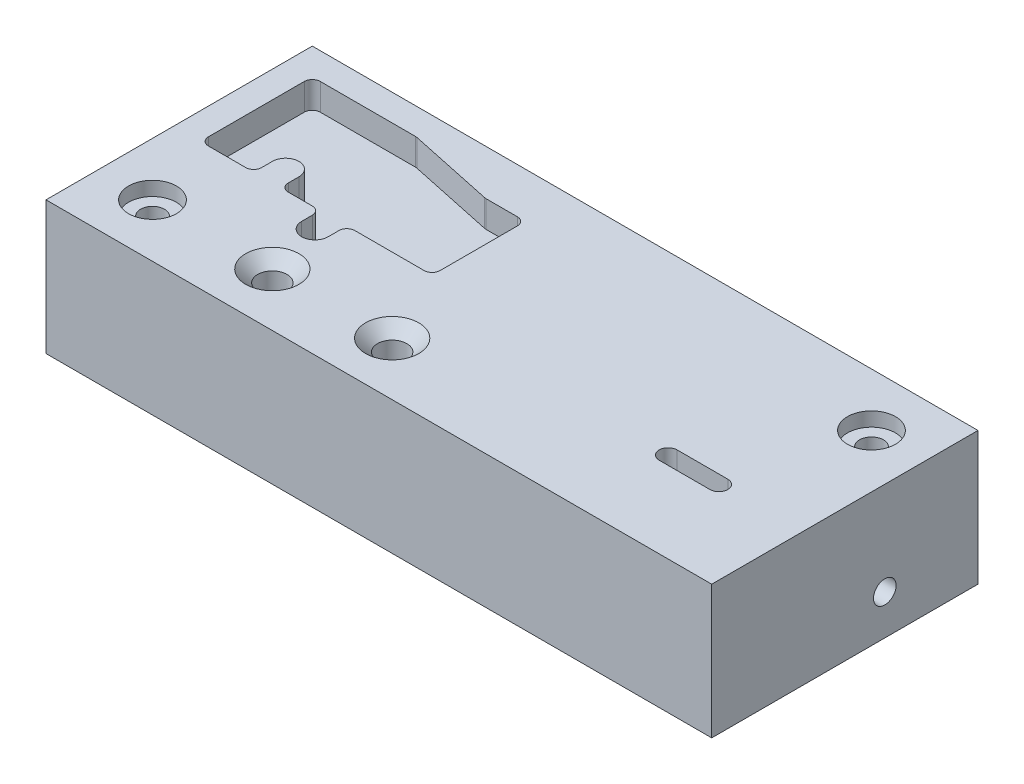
SolidWorks part; units mm, degrees
ref_plane "Front Plane" through (0, 0, 0) normal (0, 0, 1) x (1, 0, 0)
ref_plane "Top Plane" through (0, 0, 0) normal (0, 1, 0) x (1, 0, 0)
ref_plane "Right Plane" through (0, 0, 0) normal (1, 0, 0) x (0, 0, -1)
sketch "Sketch1" plane through (0, 0, 0) normal (0, 1, 0) x (1, 0, 0)
  line L0 (-125, 50) -> (125, -50) construction
  line L1 (-125, 50) -> (125, 50)
  line L2 (-125, 50) -> (-125, -50)
  line L3 (-125, -50) -> (125, -50)
  line L4 (125, 50) -> (125, -50)
  dimension "D1" = 250
  dimension "D2" = 100
extrude "Block Stock" add sketch "Sketch1" along normal blind 50
hole_wizard "M10 Tapped Hole1" positions "Sketch5" profile "Sketch4" tap size "M10" standard "ISO"
sketch "Sketch5" plane through (125, 0, 0) normal (1, 0, 0) x (0, 0, -1)
  line L0 (50, 50) -> (50, 0) construction
  line L1 (-50, 0) -> (50, 0) construction
  point P1 (15, 15)
  dimension "D1" = 35
  dimension "D2" = 15
sketch "Sketch4" plane through (125, 15, -15) normal (0, 1, 0) x (0, 0, -1)
  line L0 (0, 0) -> (0, 27.5537)
  line L1 (0, 27.5537) -> (4.25, 25)
  line L2 (4.25, 25) -> (4.25, 0)
  line L5 (4.25, 0) -> (0, 0)
  line L10 (0, 27.5537) -> (-4.25, 25) construction
  line L11 (0, -6.35) -> (0, 107.95) construction
  dimension "Tap Drill Dia." = 8.5
  dimension "Tap Drill Depth" = 25
  dimension "Drill Angle" = 118
hole_wizard "CBORE for M8 Hex Head Bolt1" positions "Sketch7" profile "Sketch6" counterbore size "M8" standard "ISO"
sketch "Sketch7" plane through (0, 50, 0) normal (0, 1, 0) x (-1, 0, 0)
  line L0 (125, 50) -> (-125, 50) construction
  line L1 (125, -50) -> (125, 50) construction
  line L2 (-125, 50) -> (-125, -50) construction
  line L3 (-125, -50) -> (125, -50) construction
  point P0 (105, 30)
  point P5 (-105, -30)
  dimension "D1" = 20
  dimension "D2" = 20
  dimension "D3" = 20
  dimension "D4" = 20
sketch "Sketch6" plane through (-105, 50, 30) normal (1, 0, 0) x (0, 0, 1)
  line L0 (0, 0) -> (0, 50)
  line L1 (0, 50) -> (4.5, 50)
  line L3 (4.5, 50) -> (4.5, 5.3)
  line L4 (4.5, 5.3) -> (9.0055, 5.3)
  line L5 (9.0055, 5.3) -> (9.0055, 0)
  line L7 (9.0055, 0) -> (0, 0)
  line L11 (0, -6.35) -> (0, 107.95) construction
  dimension "Thru Hole Dia." = 9
  dimension "Thru Hole Depth" = 50
  dimension "C'Bore Dia." = 18.011
  dimension "C'Bore Depth" = 5.3
sketch "Sketch10" plane through (0, 50, 0) normal (0, 1, 0) x (1, 0, 0)
  line L0 (125, 50) -> (-125, 50) construction
  line L1 (-125, 50) -> (-125, -50) construction
  circle A0 centre (5, 25) radius 3
  dimension "D1" = 6
  dimension "D3" = 130
  dimension "D2" = 25
extrude "PreCut for ISO11926" [suppressed] cut sketch "Sketch10" against normal blind 6
sketch "Drop location" [suppressed] plane through (-13.369, 50, 9.7542) normal (0, 1, 0) x (1, 0, 0)
  line L0 (0, 0) -> (-31.7732, 0) construction
  circle A1 centre (18.369, 34.7542) radius 3 construction
  point P0 (18.369, 34.7542)
ref_plane "Plane1" [suppressed] through (5, 50, -25) normal (-1, 0, 0) x (0, 0, 1)
sketch "Port Sketch" [suppressed] plane through (5, 50, 0) normal (1, 0, 0) x (0, 0, 1)
  line L0 (-25, 0) -> (-25, 53.9676) construction
  line L1 (-25, 19.0576) -> (-19.2456, 15.6)
  line L2 (-19.2456, 15.6) -> (-19.2456, 13.1)
  line L3 (-19.2456, 13.1) -> (-18.65, 13.1)
  line L4 (-18.65, 13.1) -> (-18.65, 3.9592)
  line L5 (-18.65, 3.9592) -> (-18.6908, 4)
  line L6 (-18.6908, 4) -> (-18.2234, 1.8012)
  line L7 (-17.975, 1.6) -> (-13.5, 1.6)
  line L8 (-13.5, 1.6) -> (-13.5, 0)
  line L10 (-13.5, 0) -> (-25, 0)
  line L11 (-25, 0) -> (-25, 19.0576)
  line L12 (-31.3092, 4) -> (-31.7766, 1.8012) construction
  line L13 (-31.35, 3.9592) -> (-31.3092, 4) construction
  line L14 (-25, 19.0576) -> (-30.7544, 15.6) construction
  arc A0 (-18.2234, 1.8012) -> (-17.975, 1.6) centre (-17.975, 1.854) ccw
  dimension "D1" = 0.254
  dimension "D2" = 118
  dimension "D3" = 45
  dimension "TapDrillDia" = 11.5087
  dimension "D5" = 14.05
  dimension "ThdMjr" = 12.7
  dimension "SpotDia" = 23
  dimension "L3" = 1.6
  dimension "L1" = 2.4
  dimension "ThdDp" = 11.5
  dimension "TapDrillDp" = 14
  dimension "K" = 12
revolve "SAE Port" [suppressed] cut sketch "Port Sketch" angle 360 about L0
other "iso 11926-1 fluid power port<1>" [suppressed]
sketch "Sketch2" plane through (0, 50, 0) normal (0, 1, 0) x (1, 0, 0)
  line L0 (-125, 50) -> (-125, -50) construction
  line L1 (-112, 40) -> (-76.2477, 40)
  line L2 (-115, 37) -> (-115, 1)
  line L3 (-112, -2) -> (-98, -2)
  line L4 (-95, 1) -> (-95, 5)
  line L5 (125, 50) -> (-125, 50) construction
  line L6 (-75.624, 39.9344) -> (-43.3084, 33.0656)
  line L7 (-85, 5) -> (-85, 1)
  line L8 (-42.6847, 33) -> (-31, 33)
  line L9 (-28, 30) -> (-28, 1)
  line L10 (-70, -5) -> (-70, -9)
  line L11 (-60, -9) -> (-60, -5)
  line L12 (-82, -2) -> (-73, -2)
  line L13 (-57, -2) -> (-31, -2)
  arc A0 (-112, 40) -> (-115, 37) centre (-112, 37) ccw
  arc A1 (-28, 30) -> (-31, 33) centre (-31, 30) ccw
  arc A2 (-31, -2) -> (-28, 1) centre (-31, 1) ccw
  arc A3 (-115, 1) -> (-112, -2) centre (-112, 1) ccw
  arc A4 (-43.3084, 33.0656) -> (-42.6847, 33) centre (-42.6847, 36) ccw
  arc A5 (-75.624, 39.9344) -> (-76.2477, 40) centre (-76.2477, 37) ccw
  arc A6 (-95, 5) -> (-85, 5) centre (-90, 5) cw
  arc A7 (-70, -9) -> (-60, -9) centre (-65, -9) ccw
  arc A8 (-60, -5) -> (-57, -2) centre (-57, -5) cw
  arc A9 (-70, -5) -> (-73, -2) centre (-73, -5) ccw
  arc A10 (-85, 1) -> (-82, -2) centre (-82, 1) ccw
  arc A11 (-95, 1) -> (-98, -2) centre (-98, 1) cw
  point P10 (-115, 40)
  point P17 (-115, -2)
  point P24 (-43, 33)
  point P37 (-60, -2)
  point P40 (-70, -2)
  point P43 (-85, -2)
  dimension "D5" = 3
  dimension "D4" = 12
  dimension "D6" = 12
  dimension "D7" = 10
  dimension "D8" = 10
  dimension "D1" = 10
  dimension "D2" = 10
  dimension "D3" = 42
  dimension "D9" = 87
  dimension "D10" = 35
  dimension "D11" = 12
  dimension "D12" = 15
  dimension "D13" = 15
  dimension "D14" = 20
extrude "Pocket 1" cut sketch "Sketch2" against normal blind 10
hole_wizard "CSK for M10 Cross Recess Flat Head Screw1" positions "Sketch13" profile "Sketch12" countersink size "M10" standard "IS"
sketch "Sketch13" plane through (0, 50, 0) normal (0, 1, 0) x (-1, 0, 0)
  line L0 (125, 50) -> (-125, 50) construction
  line L1 (125, -50) -> (125, 50) construction
  point P0 (15, 30)
  point P1 (60, 30)
  dimension "D1" = 20
  dimension "D2" = 45
  dimension "D3" = 65
sketch "Sketch12" plane through (-15, 50, 30) normal (1, 0, 0) x (0, 0, 1)
  line L0 (0, 0) -> (0, 50)
  line L1 (0, 50) -> (5.5, 50)
  line L2 (5.5, 50) -> (5.5, 4.5)
  line L3 (5.5, 4.5) -> (10, 0)
  line L5 (10, 0) -> (0, 0)
  line L6 (-5.5, 4.5) -> (-10, 0) construction
  line L11 (0, -6.35) -> (0, 107.95) construction
  dimension "Thru Hole Dia." = 11
  dimension "Thru Hole Depth" = 50
  dimension "Near C'Sink Dia." = 20
  dimension "Near C'Sink Angle" = 90
sketch "SlotSke" plane through (218.7037, 50, 182.3756) normal (0, 1, 0) x (1, 0, 0)
  line L0 (-124.8268, 166.1878) -> (-143.8768, 166.1878) construction
  line L1 (-134.3518, 162.8223) -> (-134.3518, 169.5533) construction
  line L2 (-124.8268, 162.8223) -> (-143.8768, 162.8223)
  line L3 (-143.8768, 169.5533) -> (-124.8268, 169.5533)
  line L4 (-93.7037, 132.3756) -> (-93.7037, 232.3756) construction
  line L5 (-93.7037, 132.3756) -> (-343.7037, 132.3756) construction
  arc A0 (-143.8768, 162.8223) -> (-143.8768, 169.5533) centre (-143.8768, 166.1878) cw
  arc A1 (-124.8268, 162.8223) -> (-124.8268, 169.5533) centre (-124.8268, 166.1878) ccw
  point P12 (-134.3518, 166.1878)
  dimension "Length" = 19.05
  dimension "Width" = 6.731
  dimension "Locating dim1" = 40.6482
  dimension "Locating dim2" = 33.8122
extrude "Slot" cut sketch "SlotSke" against normal through all
other "straight slot<1>"
